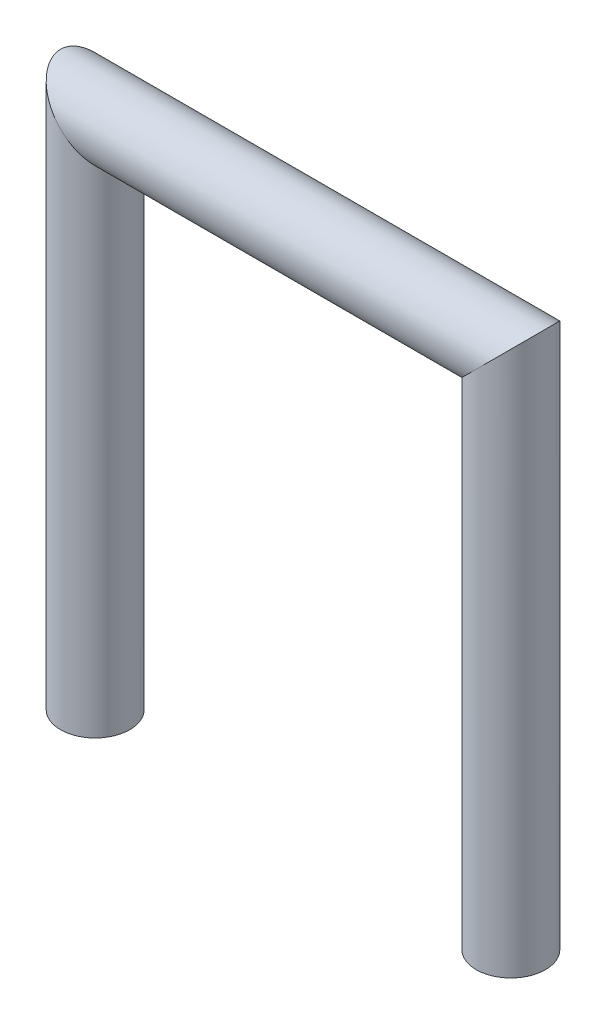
SolidWorks part; units mm, degrees
ref_plane "Front Plane" through (0, 0, 0) normal (0, 0, 1) x (1, 0, 0)
ref_plane "Top Plane" through (0, 0, 0) normal (0, 1, 0) x (1, 0, 0)
ref_plane "Right Plane" through (0, 0, 0) normal (1, 0, 0) x (0, 0, -1)
sketch "Sketch1" plane through (0, 0, 0) normal (0, 0, 1) x (1, 0, 0)
  line L2 (0, 0) -> (0, 95.331)
  line L3 (0, 95.331) -> (76.2, 95.331)
  line L4 (76.2, 0) -> (76.2, 95.331)
  dimension "D1" = 76.2
sketch "Sketch2" plane through (0, 0, 0) normal (0, 1, 0) x (1, 0, 0)
  line L2 (0, 0) -> (0, -92.5693)
  line L3 (0, -92.5693) -> (76.2, -92.5693)
  line L4 (76.2, 0) -> (76.2, -92.5693)
sketch "Sketch3" plane through (0, 0, 0) normal (0, 1, 0) x (1, 0, 0)
  circle A0 centre (76.2, 0) radius 6.35
  dimension "D1" = 12.7
sweep "Sweep4" add profiles "Sketch3" path "Sketch1"
